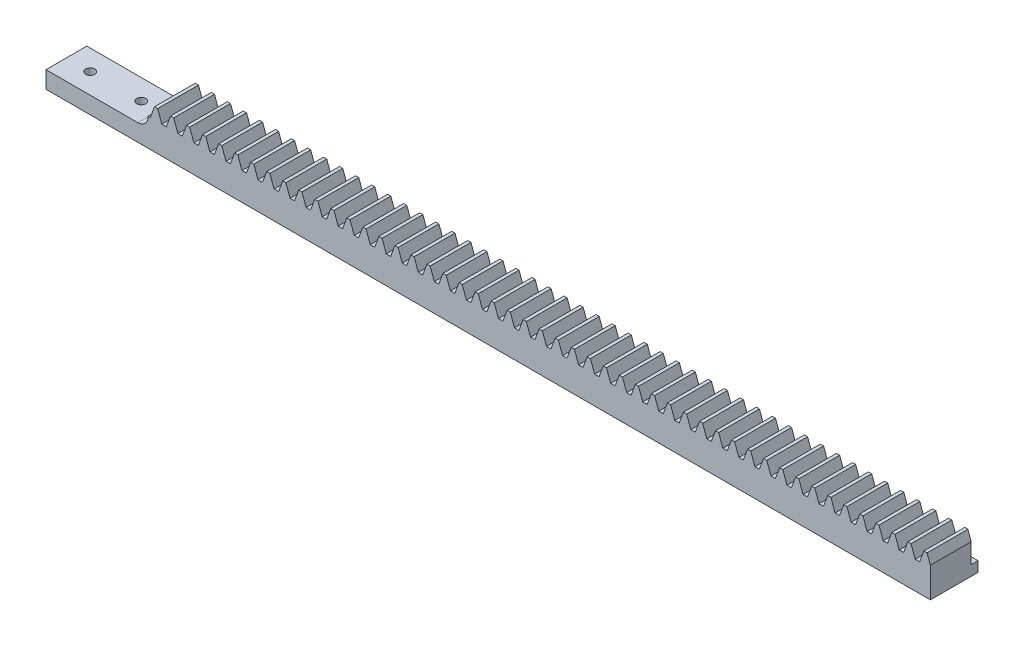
SolidWorks part; units mm, degrees
extrude "Blank" add sketch "BlankSke" against normal blind 12
sketch "BlankSke" plane through (0, 0, 0) normal (0, 0, 1) x (1, 0, 0)
  line L1 (0, 0) -> (230, 0)
  line L2 (0, 0) -> (0, 11.5)
  line L3 (0, 11.5) -> (230, 11.5)
  line L4 (230, 0) -> (230, 11.5)
ref_plane "Plane1" through (0, 0, 0) normal (0, 0, 1) x (1, 0, 0)
ref_plane "Plane2" through (0, 0, 0) normal (0, 1, 0) x (1, 0, 0)
ref_plane "Plane3" through (0, 0, 0) normal (1, 0, 0) x (0, 0, -1)
other "Configuration Table"
sketch "HoldingSke" plane through (0, 0, 0) normal (0, 1, 0) x (1, 0, 0)
  line L0 (0, 0) -> (0.0928, 0.6602)
  line L1 (-15, 0) -> (100, 0) construction
  line L2 (0, 0) -> (-2.1039, 2.3779)
  line L3 (0, 0) -> (-11.863, 4.5341)
  line L4 (0, 0) -> (5.9991, 6.2122)
  line L5 (0, 0) -> (-23.7986, -8.8762)
  line L6 (0, 0) -> (-10.5278, -7.1032)
  line L9 (-71.009, 38.7566) -> (126.3265, 110.5808)
  line L10 (-76.2, 3.8779) -> (-66.2, 3.8779)
  line L11 (0, 0) -> (-12, 0)
  line L12 (-76.2, 101.6) -> (-76.147, 101.6)
  line L13 (24.9733, 27.94) -> (52.9518, 28.4284)
  line L14 (24.9733, 27.94) -> (24.9743, 27.94)
  line L15 (24.9733, 27.94) -> (100.4006, 29.5858)
  circle A0 centre (0, 0) radius 19.05
  circle A1 centre (0, 0) radius 5
  circle A2 centre (0, 0) radius 12.7
sketch "TooCutSkeIll" plane through (0, 0, 0) normal (0, 0, 1) x (1, 0, 0)
  line L0 (-1.8687, 11.4605) -> (-0.7447, 8.3724)
  line L1 (-0.3914, 8.125) -> (0.3914, 8.125)
  line L2 (0.7447, 8.3724) -> (1.8687, 11.4605)
  line L3 (230, 11.5) -> (0, 11.5) construction
  line L4 (0, 0) -> (0, 64.897) construction
  line L5 (-13.208, 10) -> (12.954, 10) construction
  line L6 (0, 0) -> (230, 0) construction
  line L7 (1.3371, 10) -> (1.3371, 48.7463) construction
  line L8 (-1.3371, 10) -> (-1.3371, 48.7463) construction
  line L9 (1.9251, 11.5) -> (1.9251, 11.5254)
  line L10 (-1.9251, 11.5) -> (-1.9251, 11.5254)
  line L11 (-1.9251, 11.5254) -> (1.9251, 11.5254)
  arc A0 (0.3914, 8.125) -> (0.7447, 8.3724) centre (0.3914, 8.501) ccw
  arc A1 (-0.7447, 8.3724) -> (-0.3914, 8.125) centre (-0.3914, 8.501) ccw
  arc A2 (1.9251, 11.5) -> (1.8687, 11.4605) centre (1.9251, 11.44) ccw
  arc A3 (-1.8687, 11.4605) -> (-1.9251, 11.5) centre (-1.9251, 11.44) ccw
extrude "ToothCutIll" [suppressed] cut sketch "TooCutSkeIll" against normal through all
sketch "TooCutSkeSim" plane through (0, 0, 0) normal (0, 0, 1) x (1, 0, 0)
  line L0 (0.6547, 8.125) -> (-0.6547, 8.125)
  line L1 (1.8923, 11.5254) -> (0.6547, 8.125)
  line L2 (0, 17.4625) -> (0, 53.467) construction
  line L3 (1.8923, 11.5254) -> (-1.8923, 11.5254)
  line L6 (-1.8923, 11.5254) -> (-0.6547, 8.125)
  line L9 (-1.3371, 10) -> (1.3371, 10) construction
  line L10 (0, 0) -> (230, 0) construction
  line L11 (1.3371, 10) -> (1.3371, 53.467) construction
  line L12 (-1.3371, 10) -> (-1.3371, 53.467) construction
extrude "ToothCutSim" cut sketch "TooCutSkeSim" against normal through all
pattern_linear "TeethCuts" count 49 spacing 4.7124 along (1, 0, 0) of "ToothCutSim"
sketch "Sketch3" plane through (0, 0, -12) normal (0, 0, -1) x (-1, 0, 0)
  line L1 (-230, 0) -> (-21.04, 0)
  line L2 (-230, 0) -> (-230, 3)
  line L3 (-230, 3) -> (-21.04, 3)
  line L4 (-21.04, 0) -> (-21.04, 3)
  dimension "D1" = 3
  dimension "D2" = 208.96
extrude "Boss-Extrude3" add sketch "Sketch3" along normal blind 2
sketch "Sketch9" plane through (0, 0, 0) normal (-1, 0, 0) x (0, 0, 1)
  line L1 (-12, 0) -> (0, 0)
  line L2 (-12, 0) -> (-12, 5)
  line L3 (-12, 5) -> (0, 5)
  line L4 (0, 0) -> (0, 5)
  dimension "D1" = 5
  dimension "D2" = 12
extrude "Boss-Extrude7" add sketch "Sketch9" along normal blind 30
sketch "Sketch10" plane through (0, 5, 0) normal (0, 1, 0) x (1, 0, 0)
  line L0 (0, 6) -> (-30, 6) construction
  line L1 (0, 0) -> (0, 12) construction
  line L2 (-30, 0) -> (-30, 12) construction
  circle A0 centre (-8, 6) radius 1.35
  circle A1 centre (-23, 6) radius 1.35
  dimension "D1" = 8
  dimension "D3" = 2.7
  dimension "D4" = 2.7
  dimension "D2" = 23
extrude "Cut-Extrude4" cut sketch "Sketch10" against normal blind 10
fillet "Fillet8" radius 3 1 edges at (0, 5, -6)
equation "' \"Module@HoldingSke\" = 6.35"
equation "' \"Num_teeth@HoldingSke\" = 12"
equation "' \"Ap@HoldingSke\" =  20"
equation "' \"Ap@HoldingSke\" = 20"
equation "' \"Width@HoldingSke\" = 0.25 * 25.4"
equation "' \"Show_teeth@HoldingSke\" = 500"
equation "' \"Backlash@HoldingSke\" = 0.009 * 25.4"
equation "' \"Addendum_fac@HoldingSke\" = 1.0"
equation "' \"Dedendum_fac@HoldingSke\" = 1.25"
equation "' \"Dedendum_add@HoldingSke\" = 0.00005 * 25.4"
equation "' \"Clearance_fac@HoldingSke\" = 0.25"
equation "' \"Pitch_height@HoldingSke\" = 1 * 25.4"
equation "' \"Length@HoldingSke\" = 4.71 * 25.4"
equation "\"Pitch@HoldingSke\" = 1 / \"Module@HoldingSke\""
equation "\"MPH@HoldingSke\" = \"Dedendum_fac@HoldingSke\" / \"Pitch@HoldingSke\" + 2 * \"Dedendum_add@HoldingSke\" + 0.002 * 25.4"
equation "\"MPH@HoldingSke\" = ((sgn( \"MPH@HoldingSke\" - \"Pitch_height@HoldingSke\")+1)*( \"MPH@HoldingSke\" - \"Pitch_height@HoldingSke\"))/2 + \"Pitch_height@HoldingSke\""
equation "\"Blank_height@BlankSke\"=\"Pitch_height@HoldingSke\" + \"Addendum_fac@HoldingSke\"  / \"Pitch@HoldingSke\""
equation "\"Length@BlankSke\"=230"
equation "\"Face_width@Blank\" = \"Width@HoldingSke\""
equation "\"Pressure_angle@TooCutSkeIll\" = \"Ap@HoldingSke\""
equation "\"Addendum_plus@TooCutSkeIll\" =  \"Addendum_fac@HoldingSke\"  / \"Pitch@HoldingSke\" + 0.001 *25.4"
equation "\"Dedendum@TooCutSkeIll\" = \"Dedendum_fac@HoldingSke\"  / \"Pitch@HoldingSke\""
equation "\"Pitch_height@TooCutSkeIll\" =  \"MPH@HoldingSke\""
equation "\"Gap_width@TooCutSkeIll\" = 3.14159265 / 2 / \"Pitch@HoldingSke\" + 6 * \"Backlash@HoldingSke\""
equation "\"Pressure_angle@TooCutSkeSim\" = \"Ap@HoldingSke\""
equation "\"Addendum_plus@TooCutSkeSim\" =  \"Addendum_fac@HoldingSke\"  / \"Pitch@HoldingSke\" + 0.001 * 25.4"
equation "\"Dedendum@TooCutSkeSim\" = \"Dedendum_fac@HoldingSke\"  / \"Pitch@HoldingSke\""
equation "\"Pitch_height@TooCutSkeSim\" =  \"MPH@HoldingSke\""
equation "\"Gap_width@TooCutSkeSim\" = 3.14159265 / 2 / \"Pitch@HoldingSke\" + 6 * \"Backlash@HoldingSke\""
equation "\"Root_fillet@TooCutSkeIll\" = \"Clearance_fac@HoldingSke\" / \"Pitch@HoldingSke\" + \"Dedendum_add@HoldingSke\""
equation "\"Break_rad@TooCutSkeIll\" = 0.02 / \"Pitch@HoldingSke\" * 2"
equation "\"Linear_pitch@TeethCuts\" = 3.14159265 / \"Pitch@HoldingSke\""
equation "\"Num_teeth@HoldingSke\" = int( ( \"Length@HoldingSke\" + 0 ) / (3.14159265 / \"Pitch@HoldingSke\")) + 0.9999  + 1"
equation "\"Num_teeth@TeethCuts\"=50"
equation " \"Num_teeth@TeethCuts\" = ((sgn( \"Num_teeth@TeethCuts\" - \"Num_teeth@HoldingSke\" )-1)*( \"Num_teeth@TeethCuts\" - \"Num_teeth@HoldingSke\" ))/-2+ \"Num_teeth@HoldingSke\""
